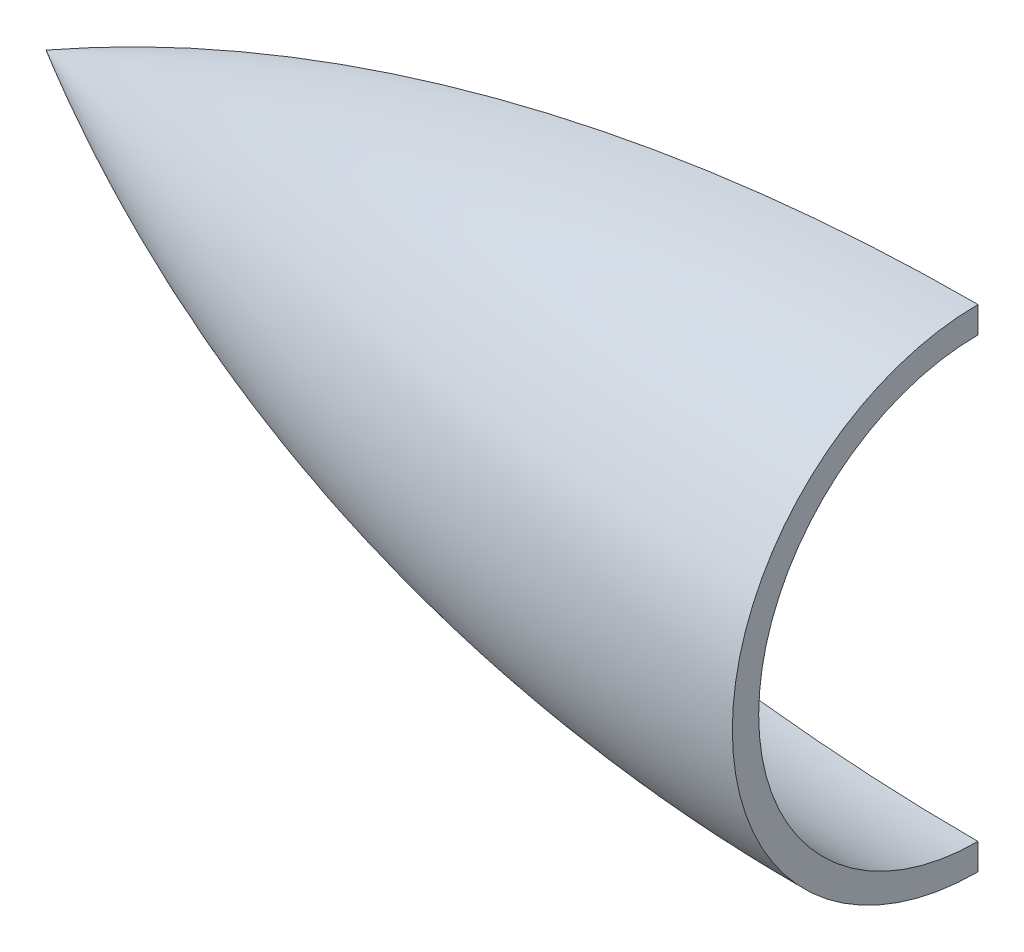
SolidWorks part; units mm, degrees
ref_plane "Front Plane" through (0, 0, 0) normal (0, 0, 1) x (1, 0, 0)
ref_plane "Top Plane" through (0, 0, 0) normal (0, 1, 0) x (1, 0, 0)
ref_plane "Right Plane" through (0, 0, 0) normal (1, 0, 0) x (0, 0, -1)
sketch "Sketch1" plane through (0, 0, 0) normal (0, 0, 1) x (1, 0, 0)
  line L0 (0, 107.95) -> (0, 109.474)
  line L1 (-53.9629, 95.25) -> (-50.8, 95.25)
  arc A0 (0, 107.95) -> (-50.8, 95.25) centre (0, 0) ccw
  arc A2 (0, 109.474) -> (-53.9629, 95.25) centre (0, 0) ccw
  dimension "D1" = 1.524
  dimension "D2" = 107.95
  dimension "D3" = 109.474
revolve "Revolve4" add sketch "Sketch1" angle 180 about L1
